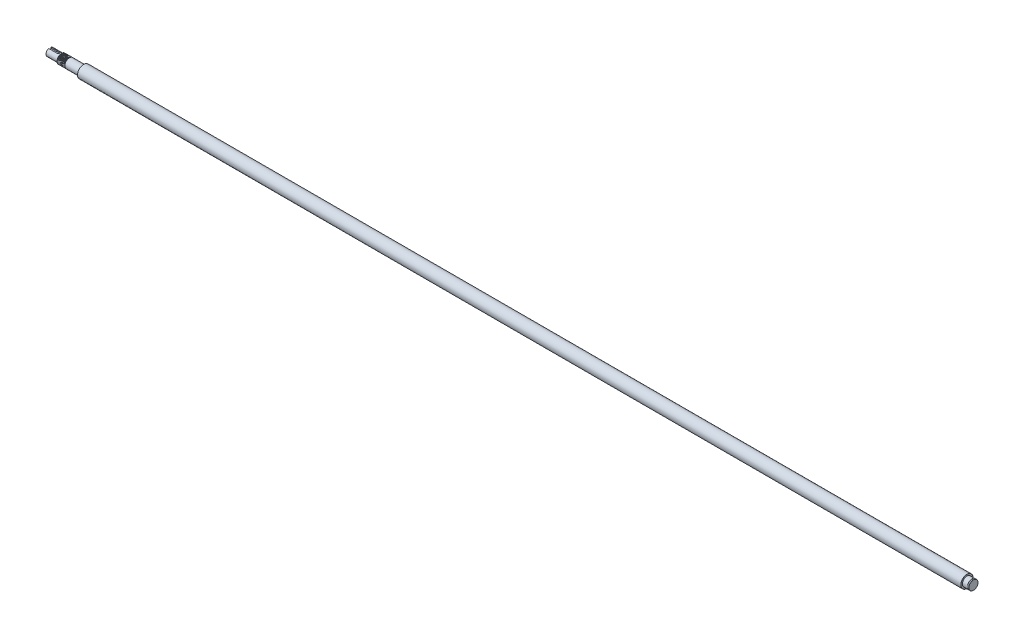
SolidWorks part; units mm, degrees
ref_plane "Front Plane" through (0, 0, 0) normal (0, 0, 1) x (1, 0, 0)
ref_plane "Top Plane" through (0, 0, 0) normal (0, 1, 0) x (1, 0, 0)
ref_plane "Right Plane" through (0, 0, 0) normal (1, 0, 0) x (0, 0, -1)
sketch "Sketch1" plane through (0, 0, 0) normal (0, 0, 1) x (1, 0, 0)
  line L0 (0, 0) -> (147.5, 0) construction
  line L1 (0, 0) -> (0, 12.5)
  line L2 (0, 12.5) -> (38, 12.5)
  line L3 (38, 12.5) -> (38, 15)
  line L4 (38, 15) -> (110, 15)
  line L5 (110, 15) -> (110, 20)
  line L6 (110, 20) -> (2979, 20)
  line L7 (2979, 20) -> (2979, 15)
  line L8 (2979, 15) -> (2995, 15)
  line L9 (2995, 15) -> (2995, 14.3)
  line L10 (2995, 14.3) -> (2996.75, 14.3)
  line L11 (2996.75, 14.3) -> (2996.75, 15)
  line L12 (2996.75, 15) -> (3000, 15)
  line L13 (3000, 15) -> (3000, 0)
  line L14 (0, 0) -> (3000, 0)
  point P17 (2996.75, 14.65)
  dimension "D1" = 12.5
  dimension "D2" = 2.5
  dimension "D3" = 38
  dimension "D4" = 72
  dimension "D5" = 5
  dimension "D6" = 1.75
  dimension "D7" = 21
  dimension "D8" = 3.25
  dimension "D9" = 3000
  dimension "D10" = 0.7
revolve "Revolve1" add sketch "Sketch1" angle 360 about L0
chamfer "Chamfer1" distance 0.2 angle 45 3 edges at (0, 0, 12.5) (2979, 0, 20) (3000, 0, 15)
thread "Thread1" pitch 1.5 start angle 0, offset 0, length 25, pitch 1.5, diameter 30
ref_plane "Plane1" through (38, 0, -15) normal (0, -1, 0) x (0, 0, -1)
sketch "Thread Profile1" plane through (38, 0, -15) normal (0, -1, 0) x (0, 0, -1)
  line L0 (0, 0) -> (0, 1.5) construction
  line L11 (0, 0) -> (0, 1.3125)
  line L12 (0, 1.3125) -> (-0.8119, 0.8437)
  line L13 (-0.8119, 0.8437) -> (-0.8119, 0.4687)
  line L15 (-0.8119, 0.4687) -> (0, 0)
  line L17 (-0.8119, 0.6562) -> (0, 0.6562) construction
  point P2 (0, 0)
  dimension "Pitch" = 1.5
  dimension "Profile_Angle" = 60
  dimension "Profile_Land" = 0.375
  dimension "Profile_Height" = 0.8119
ref_plane "Plane3" through (0, 8, 0) normal (0, 1, 0) x (1, 0, 0)
sketch "Sketch18" plane through (0, 8, 0) normal (0, 1, 0) x (1, 0, 0)
  line L0 (0, 0) -> (28, 0) construction
  line L1 (0, 4) -> (28, 4)
  line L2 (0, -4) -> (28, -4)
  line L3 (0, 12.3) -> (0, -12.3) construction
  arc A0 (0, 4) -> (0, -4) centre (0, 0) ccw
  arc A1 (28, -4) -> (28, 4) centre (28, 0) ccw
  point P3 (14, 0)
  dimension "D1" = 8
  dimension "D2" = 28
extrude "Cut-Extrude1" cut sketch "Sketch18" along normal blind 5
